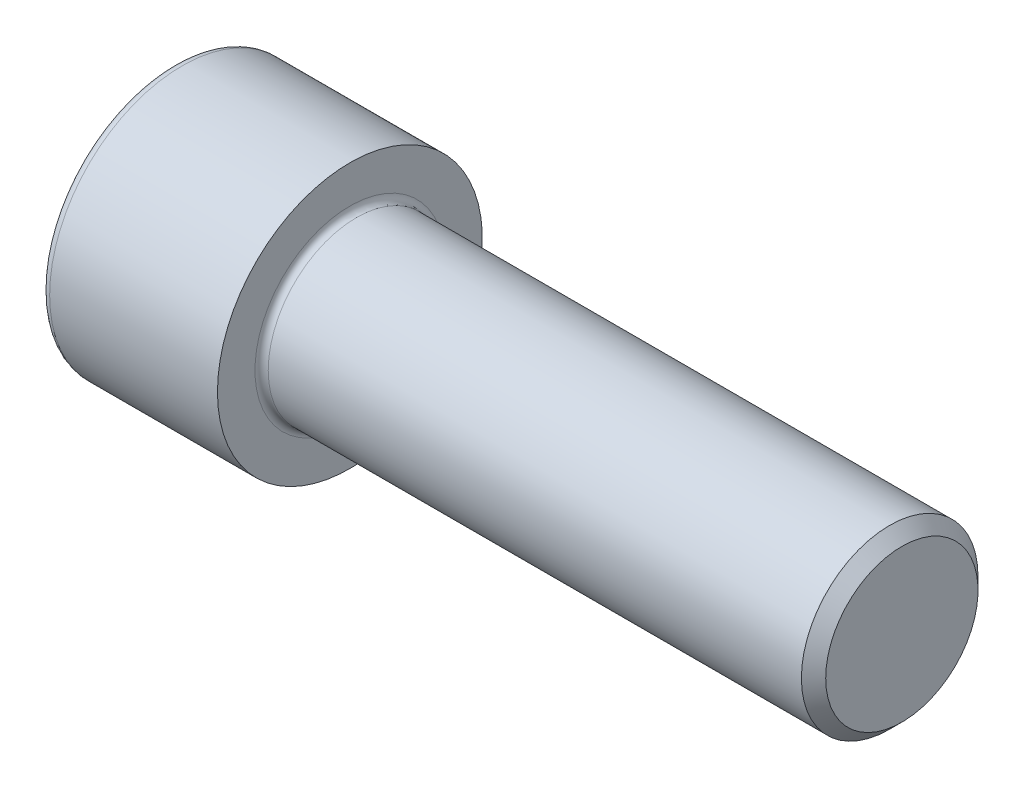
SolidWorks part; units mm, degrees
ref_plane "Plane1" through (0, 0, 0) normal (0, 0, 1) x (1, 0, 0)
ref_plane "Plane2" through (0, 0, 0) normal (0, 1, 0) x (1, 0, 0)
ref_plane "Plane3" through (0, 0, 0) normal (1, 0, 0) x (0, 0, -1)
sketch "BodySke" plane through (0, 0, 0) normal (0, 0, 1) x (1, 0, 0)
  line L0 (0, 0) -> (0, 12)
  line L1 (0, 12) -> (16, 12)
  line L2 (16, 12) -> (16, 8)
  line L3 (16, 8) -> (64.8985, 8)
  line L4 (66, 6.8985) -> (66, 0)
  line L5 (66, 0) -> (0, 0)
  line L6 (-31.75, 0) -> (127, 0) construction
  line L8 (66, 6.8985) -> (64.8985, 8)
  line L10 (66, -6.8985) -> (64.8985, -8) construction
  line L11 (18, 9.525) -> (18, 3.175) construction
  line L12 (16, 9.525) -> (16, 3.175) construction
  line L13 (6, 9.525) -> (6, 3.175) construction
  dimension "Diameter" = 16
  dimension "Head_ht" = 16
  dimension "Length" = 50
  dimension "Body_ch_ang" = 45
  dimension "Head_dia" = 24
  dimension "Minor_dia" = 13.797
  dimension "Advance" = 2
  dimension "Thread_nom" = 50
  dimension "Thread_length" = 60
revolve "Base-Revolve" add sketch "BodySke"
fillet "Fillet1" radius 0.6 1 edges at (16, 0, 8)
fillet "Fillet2" radius 0.8 1 edges at (0, 0, 12)
sketch "Sketch2" plane through (0, 0, 0) normal (0, 0, 1) x (1, 0, 0)
  line L0 (0, 7.071) -> (8, 7.071)
  line L1 (8, 7.071) -> (12.0824, 0)
  line L2 (-31.75, 0) -> (127, 0) construction
  line L3 (12.0824, 0) -> (0, 0)
  line L4 (0, 0) -> (0, 7.071)
  line L6 (0, 0) -> (47.625, 0) construction
  dimension "D1" = 7.071
  dimension "D2" = 60
  dimension "Depth" = 8
revolve "Hex-PreBroach" cut sketch "Sketch2" angle 360 about L6
sketch "Sketch3" plane through (0, 0, 0) normal (-1, 0, 0) x (0, 0.5, 0.866)
  line L0 (4.0824, 7.071) -> (-4.0824, 7.071)
  line L1 (-4.0824, 7.071) -> (-8.1649, 0)
  line L2 (4.0824, 7.071) -> (8.1649, 0)
  line L3 (4.0824, -7.071) -> (8.1649, 0)
  line L4 (4.0824, -7.071) -> (-4.0824, -7.071)
  line L5 (-4.0824, -7.071) -> (-8.1649, 0)
  dimension "D1" = 7.071
  dimension "D2" = 7.071
  dimension "Hex_size" = 14.142
extrude "Hex" cut sketch "Sketch3" against normal blind 8
sketch "ThdSchSke" plane through (0, 0, 0) normal (0, 0, 1) x (1, 0, 0)
  line L0 (22, -6.8985) -> (21.2287, -8)
  line L1 (22, -6.8985) -> (22.7713, -8)
  line L2 (22.7713, -8) -> (22.7713, -10)
  line L3 (-3.175, 0) -> (5.1513, 0) construction
  line L4 (0, 11.2) -> (0, -11.2) construction
  line L5 (22.7713, -10) -> (21.2287, -10)
  line L6 (21.2287, -10) -> (21.2287, -8)
  dimension "Thread_minor" = 13.797
  dimension "Diameter" = 16
  dimension "Start" = 22
  dimension "SideAngle" = 55
  dimension "VeeAngle" = 70
  dimension "Overcut" = 20
revolve "ThreadSchematic" [suppressed] cut sketch "ThdSchSke" angle 360 about L3
pattern_linear "ThdSchPat" [suppressed]
equation "\"D2@Sketch3\" = \"Hex_size@Sketch3\" / 2"
equation "\"D1@Sketch3\" = \"Hex_size@Sketch3\" / 2"
equation "\"D1@Sketch2\" = \"Hex_size@Sketch3\" / 2"
equation "\"Thread_minor@ThreadCosmetic\"  =  \"Minor_dia@BodySke\""
equation "\"Depth@Sketch2\" =  \"Key_eng@Hex\""
equation "\"Thread_length@ThreadCosmetic\" = ((sgn( (\"Length@BodySke\" - \"Advance@BodySke\" * 3.0) - \"Thread_nom@BodySke\" )-1)*( (\"Length@BodySke\" - \"Advance@BodySke\" * 3.0) - \"Thread_nom@BodySke\" ))/-2+ \"Thread_no"
equation "\"Thread_minor@ThdSchSke\" = \"Minor_dia@BodySke\""
equation "\"Diameter@ThdSchSke\" = \"Diameter@BodySke\""
equation "\"Overcut@ThdSchSke\" = \"Diameter@BodySke\" * 1.25"
equation "\"Start@ThdSchSke\" = \"Head_ht@BodySke\" + \"Length@BodySke\" - \"Thread_length@ThreadCosmetic\"  '---Non-countersunk---"
equation "\"Num_threads@ThdSchPat\" = int( \"Thread_length@ThreadCosmetic\" / \"Advance@BodySke\" + 0.999 )  + 1"
equation "\"Advance@ThdSchPat\" = \"Thread_length@ThreadCosmetic\" /  (\"Num_threads@ThdSchPat\" - 1) 'relax it"
equation "\"Num_threads@ThdSchPat\" = \"Num_threads@ThdSchPat\" - sgn( \"Num_threads@ThdSchPat\" - 1) '---chamfered tips only---"
